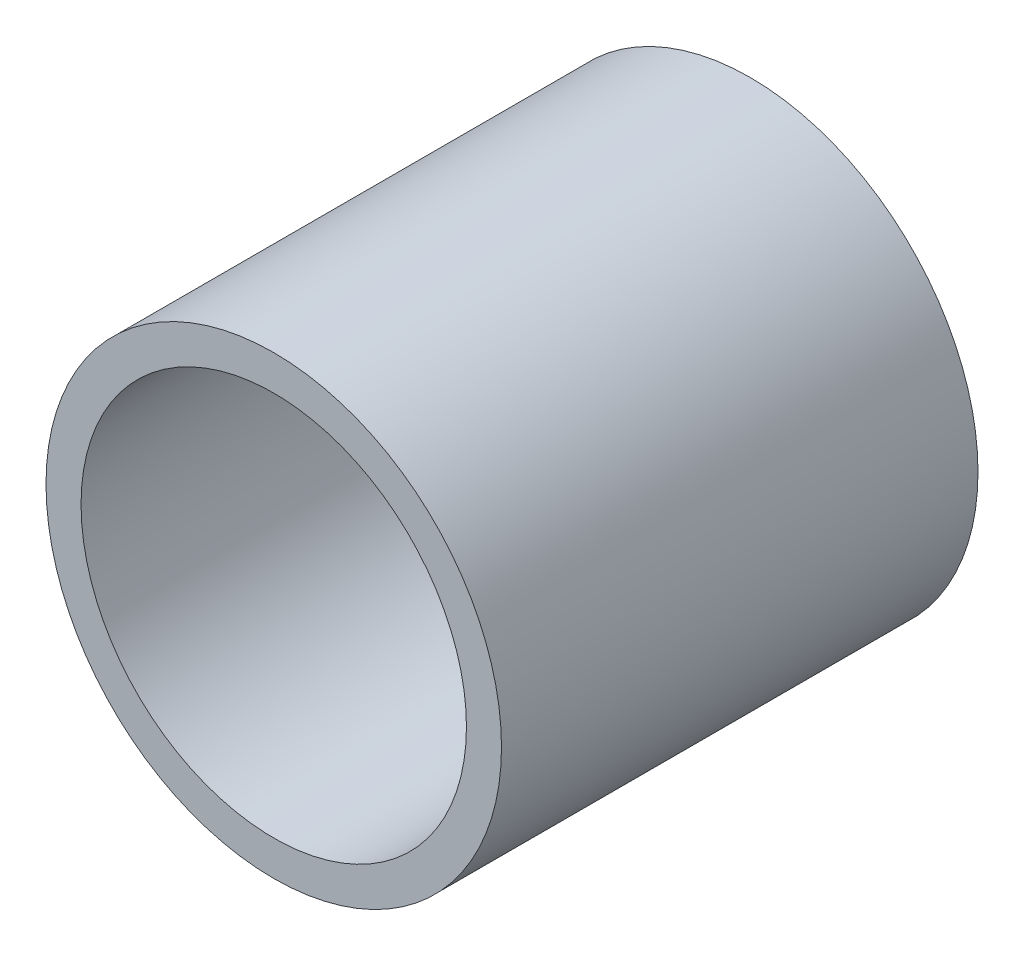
SolidWorks part; units mm, degrees
ref_plane "Plan1" through (0, 0, 0) normal (0, 0, 1) x (1, 0, 0)
ref_plane "Plan2" through (0, 0, 0) normal (0, 1, 0) x (1, 0, 0)
ref_plane "Plan3" through (0, 0, 0) normal (1, 0, 0) x (0, 0, -1)
sketch "Esquisse1" plane through (0, 0, 0) normal (0, 0, 1) x (1, 0, 0)
  circle A0 centre (0, 0) radius 6.5
  dimension "D1" = 13
extrude "Base-Extrusion" add sketch "Esquisse1" along normal blind 13.6
sketch "Esquisse2" plane through (0, 0, 13.6) normal (0, 0, 1) x (1, 0, 0)
  circle A0 centre (0, 0) radius 5.5
  dimension "D1" = 11
extrude "Enlèv. mat.-Extru.1" cut sketch "Esquisse2" against normal blind 14
